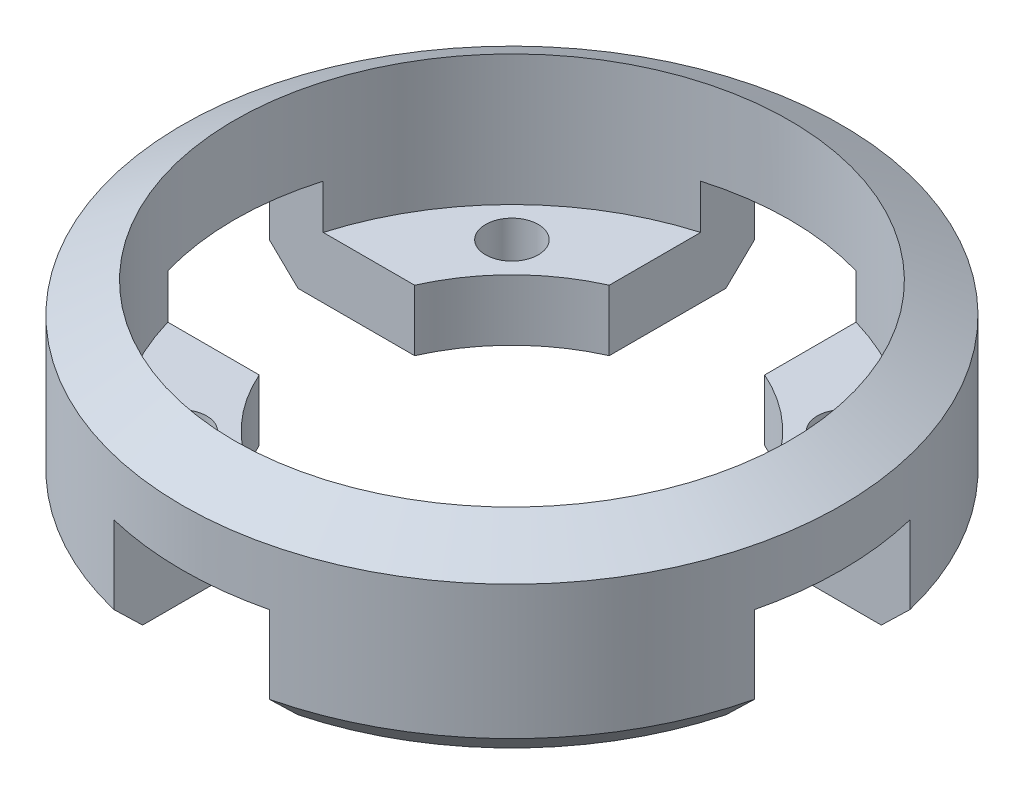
SolidWorks part; units mm, degrees
ref_plane "Front Plane" through (0, 0, 0) normal (0, 0, 1) x (1, 0, 0)
ref_plane "Top Plane" through (0, 0, 0) normal (0, 1, 0) x (1, 0, 0)
ref_plane "Right Plane" through (0, 0, 0) normal (1, 0, 0) x (0, 0, -1)
sketch "Sketch1" plane through (0, 0, 0) normal (0, 0, 1) x (1, 0, 0)
  line L0 (0, 0) -> (-55.245, 0)
  line L1 (-60.325, 5.08) -> (-60.325, 29.5527)
  line L2 (-60.325, 29.5527) -> (-50.8, 35.052)
  line L3 (-50.8, 35.052) -> (-50.8, 11.176)
  line L4 (-50.8, 11.176) -> (0, 11.176)
  line L5 (0, 11.176) -> (0, 0)
  line L6 (-55.245, 0) -> (-60.325, 5.08)
  point P1 (-60.325, 0)
  dimension "D1" = 30
  dimension "D2" = 35.052
  dimension "D3" = 60.325
  dimension "D4" = 50.8
  dimension "D5" = 23.876
revolve "Revolve1" add sketch "Sketch1" angle 360 about L5
sketch "Sketch2" plane through (0, 0, 0) normal (0, -1, 0) x (1, 0, 0)
  circle A0 centre (0, 0) radius 35.052
  circle A1 centre (0, 0) radius 42.926 construction
  dimension "D1" = 35.052
  dimension "D2" = 85.852
extrude "Cut-Extrude1" cut sketch "Sketch2" against normal through all
sketch "Sketch4" plane through (0, 0, 0) normal (0, -1, 0) x (1, 0, 0)
  line L0 (-60.325, 14.224) -> (-60.325, -14.224)
  line L1 (0, -74.692) -> (0, 69.5013) construction
  line L2 (60.325, 14.224) -> (14.224, 14.224)
  line L3 (60.325, 14.224) -> (60.325, -14.224)
  line L4 (60.325, -14.224) -> (14.224, -14.224)
  line L5 (14.224, -60.325) -> (-14.224, -60.325)
  line L6 (71.8847, 0) -> (-74.0562, 0) construction
  line L7 (14.224, 60.325) -> (-14.224, 60.325)
  line L8 (14.224, 60.325) -> (14.224, 14.224)
  line L9 (-14.224, 14.224) -> (-60.325, 14.224)
  line L10 (-14.224, 60.325) -> (-14.224, 14.224)
  line L11 (-14.224, -14.224) -> (-14.224, -60.325)
  line L12 (14.224, -14.224) -> (14.224, -60.325)
  line L13 (-14.224, -14.224) -> (-60.325, -14.224)
  dimension "D1" = 28.448
  dimension "D2" = 60.325
extrude "Cut-Extrude3" cut sketch "Sketch4" against normal blind 19.304
sketch "Sketch5" plane through (0, 0, 0) normal (0, 1, 0) x (1, 0, 0)
  line L0 (0, 0) -> (54.9899, -54.9899) construction
  line L1 (0, 0) -> (0, 66.162) construction
  line L2 (0, 0) -> (-55.8939, -55.8939) construction
  line L3 (0, 0) -> (0, -66.8916) construction
  line L4 (73.4075, 0) -> (-70.7449, 0) construction
  circle A0 centre (0, 0) radius 42.926 construction
  circle A1 centre (30.3533, -30.3533) radius 4.826
  circle A2 centre (-30.3533, -30.3533) radius 4.826
  circle A3 centre (-30.3533, 30.3533) radius 4.826
  circle A4 centre (30.3533, 30.3533) radius 4.826
  point P19 (0, 0)
  dimension "D1" = 45
  dimension "D2" = 85.852
  dimension "D3" = 9.652
  dimension "D5" = 45
  dimension "D4" = 4
extrude "Cut-Extrude4" cut sketch "Sketch5" along normal through all
